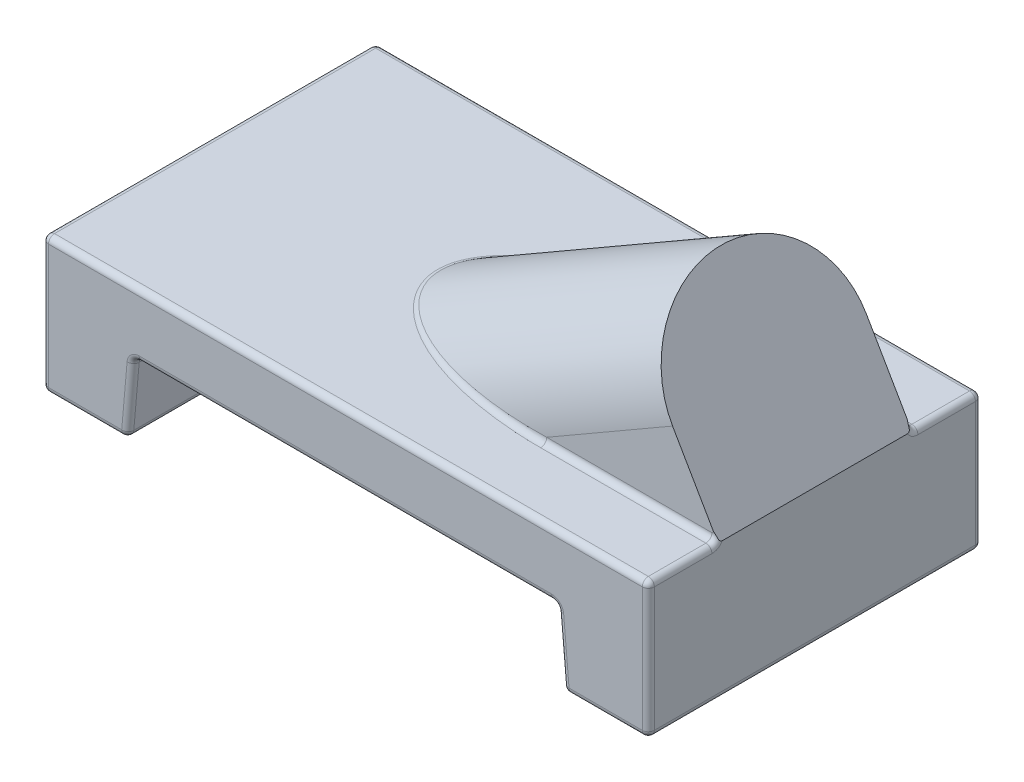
SolidWorks part; units mm, degrees
ref_plane "Front Plane" through (0, 0, 0) normal (0, 0, 1) x (1, 0, 0)
ref_plane "Top Plane" through (0, 0, 0) normal (0, 1, 0) x (1, 0, 0)
ref_plane "Right Plane" through (0, 0, 0) normal (1, 0, 0) x (0, 0, -1)
sketch "Sketch1" plane through (0, 0, 0) normal (0, 1, 0) x (1, 0, 0)
  line L0 (-63.5, 34.925) -> (63.5, -34.925) construction
  line L1 (-63.5, 34.925) -> (63.5, 34.925)
  line L2 (-63.5, 34.925) -> (-63.5, -34.925)
  line L3 (-63.5, -34.925) -> (63.5, -34.925)
  line L4 (63.5, 34.925) -> (63.5, -34.925)
  dimension "D1" = 127
  dimension "D2" = 69.85
extrude "Extrude1" add sketch "Sketch1" along normal blind 28.575
ref_plane "Plane1" through (59.9983, 34.6401, 0) normal (0.866, 0.5, 0) x (0, 0, -1)
sketch "Sketch2" plane through (59.9983, 34.6401, 0) normal (0.866, 0.5, 0) x (0, 0, -1)
  line L0 (0, 0) -> (0, 42.9694) construction
  line L1 (-20.32, -7.0033) -> (-20.32, 12.0467)
  line L2 (20.32, 12.0467) -> (20.32, -7.0033)
  line L3 (-34.925, -7.0033) -> (34.925, -7.0033) construction
  line L4 (-20.32, -7.0033) -> (20.32, -7.0033)
  arc A0 (-20.32, 12.0467) -> (20.32, 12.0467) centre (0, 12.0467) cw
  dimension "D1" = 20.32
  dimension "D2" = 19.05
extrude "Extrude2" add sketch "Sketch2" against normal up to next
sketch "Sketch3" plane through (0, 0, 0) normal (0, 0, 1) x (1, 0, 0)
  line L0 (-45.72, 0) -> (-44.3867, 15.24)
  line L1 (-63.5, 0) -> (63.5, 0) construction
  line L2 (-44.3867, 15.24) -> (44.3867, 15.24)
  line L3 (44.3867, 15.24) -> (45.72, 0)
  line L4 (45.72, 0) -> (-45.72, 0)
  dimension "D1" = 15.24
  dimension "D2" = 85
  dimension "D3" = 85
  dimension "D4" = 17.78
  dimension "D5" = 17.78
extrude "Cut-Extrude1" cut sketch "Sketch3" against normal through all and the other way through all
fillet "Fillet6" radius 1.27 6 edges at (45.72, 0, 0) (-45.72, 0, 0) (-44.3867, 15.24, 0) (44.3867, 15.24, 0) (63.5, 0, 0) (-63.5, 0, 0)
fillet "Fillet3" radius 1.27 27 edges at (0, 15.24, -34.925) (-45.0533, 7.62, -34.925) (-54.5569, 0, -34.925) (54.5569, 0, -34.925) (45.0533, 7.62, -34.925) (-63.128, 0.372, -34.925) (-46.0257, 0.3337, -34.925) (46.0257, 0.3337, -34.925) (63.128, 0.372, -34.925) (54.5569, 0, 34.925) (-54.5569, 0, 34.925) (-45.0533, 7.62, 34.925) (0, 15.24, 34.925) (45.0533, 7.62, 34.925) (-63.128, 0.372, 34.925) (-46.0257, 0.3337, 34.925) (46.0257, 0.3337, 34.925) (63.128, 0.372, 34.925) (44.0809, 14.9063, 34.925) (44.0809, 14.9063, -34.925) (-44.0809, 14.9063, 34.925) (-44.0809, 14.9063, -34.925) (-63.5, 14.9225, -34.925) (63.5, 14.9225, -34.925) (63.5, 14.9225, 34.925) (-63.5, 14.9225, 34.925)
fillet "Fillet4" radius 1.27 5 edges at (-15.24, 28.575, 0)
fillet "Fillet5" radius 1.27 13 edges at (0, 28.575, 34.925) (-63.5, 28.575, 0) (-63.128, 28.575, 34.553) (-63.128, 28.575, -34.553) (63.128, 28.575, -34.553) (63.128, 28.575, 34.553) (63.2852, 28.947, -20.692) (63.2852, 28.947, 20.692) (0, 28.575, -34.925)
sketch "Sketch4" plane through (59.9983, 34.6401, 0) normal (0.866, 0.5, 0) x (0, 0, -1)
  circle A0 centre (0, 12.0467) radius 11.1125
  dimension "D1" = 22.225
extrude "Cut-Extrude2" cut sketch "Sketch4" against normal up to next
sketch "Sketch5" plane through (0, 28.575, 0) normal (0, 1, 0) x (-1, 0, 0)
  line L0 (63.5, 33.655) -> (63.5, -33.655) construction
  circle A0 centre (38.1, 0) radius 4.7625
  dimension "D2" = 9.525
  dimension "D1" = 25.4
extrude "Cut-Extrude3" cut sketch "Sketch5" against normal through all
sketch "Sketch6" plane through (63.5, 0, 0) normal (1, 0, 0) x (0, 0, -1)
  line L0 (0, 0) -> (0, 13.8081) construction
  line L1 (-15.875, 0) -> (-22.3275, 11.176)
  line L2 (-33.655, 0) -> (33.655, 0) construction
  line L3 (-22.3275, 11.176) -> (22.3275, 11.176)
  line L4 (15.875, 0) -> (22.3275, 11.176)
  line L5 (-15.875, 0) -> (15.875, 0)
  line L7 (-34.925, 1.27) -> (-34.925, 27.305) construction
  point P9 (0, 11.176)
  dimension "D1" = 60
  dimension "D2" = 19.05
  dimension "D3" = 11.176
extrude "Cut-Extrude4" cut sketch "Sketch6" against normal through all
